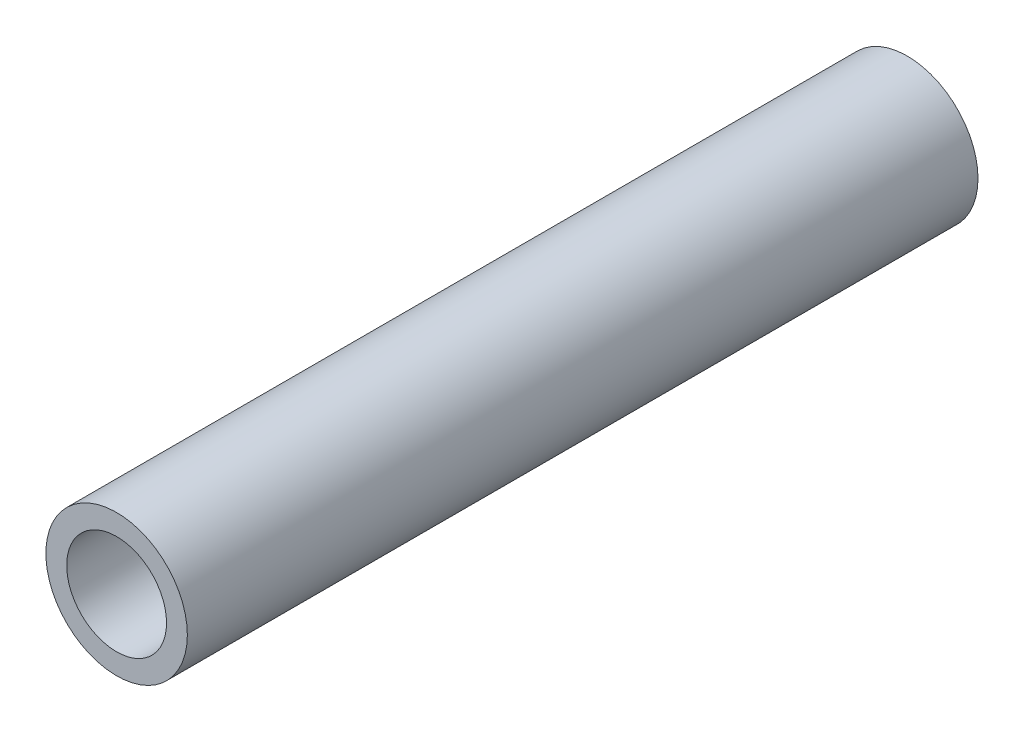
SolidWorks part; units mm, degrees
ref_plane "Plan de face" through (0, 0, 0) normal (0, 0, 1) x (1, 0, 0)
ref_plane "Plan de dessus" through (0, 0, 0) normal (0, 1, 0) x (1, 0, 0)
ref_plane "Plan de droite" through (0, 0, 0) normal (1, 0, 0) x (0, 0, -1)
sketch "Esquisse1" plane through (0, 0, 0) normal (0, 0, 1) x (1, 0, 0)
  circle A0 centre (0, 0) radius 8.5
  circle A1 centre (0, 0) radius 6
  dimension "D2" = 12
  dimension "D1" = 17
extrude "Extrusion1" add sketch "Esquisse1" along normal blind 95
